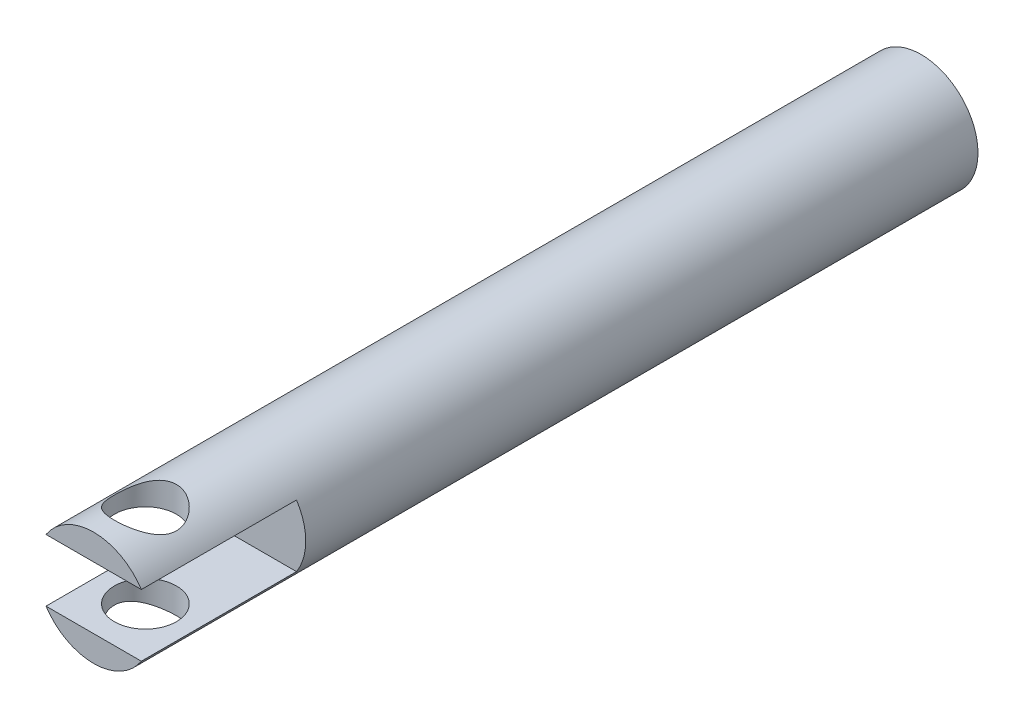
SolidWorks part; units mm, degrees
ref_plane "Plan de face" through (0, 0, 0) normal (0, 0, 1) x (1, 0, 0)
ref_plane "Plan de dessus" through (0, 0, 0) normal (0, 1, 0) x (1, 0, 0)
ref_plane "Plan de droite" through (0, 0, 0) normal (1, 0, 0) x (0, 0, -1)
sketch "Esquisse1" plane through (0, 0, 0) normal (0, 0, 1) x (1, 0, 0)
  circle A0 centre (0, 0) radius 11
  dimension "D1" = 22
extrude "Extrusion1" add sketch "Esquisse1" along normal blind 160
sketch "Esquisse2" plane through (0, 0, 160) normal (0, 0, 1) x (1, 0, 0)
  line L0 (11, 0) -> (-11, 0)
  line L1 (11, 0) -> (11, 6)
  line L2 (11, 6) -> (-11, 6)
  line L3 (-11, 0) -> (-11, -6)
  line L4 (11, -6) -> (-11, -6)
  line L5 (11, 0) -> (11, -6)
  line L6 (-11, 0) -> (-11, 6)
  circle A0 centre (0, 0) radius 11 construction
  dimension "D1" = 6
  dimension "D2" = 6
extrude "Enlèv. mat.-Extru.2" cut sketch "Esquisse2" against normal blind 30 contours L6 L2 L1 L5 L4 L3
sketch "Esquisse3" plane through (0, 6, 0) normal (0, -1, 0) x (1, 0, 0)
  line L0 (9.2195, 160) -> (-9.2195, 160) construction
  circle A0 centre (0, 150) radius 6
  dimension "D1" = 10
  dimension "D2" = 12
extrude "Enlèv. mat.-Extru.3" cut sketch "Esquisse3" against normal through all and the other way through all
